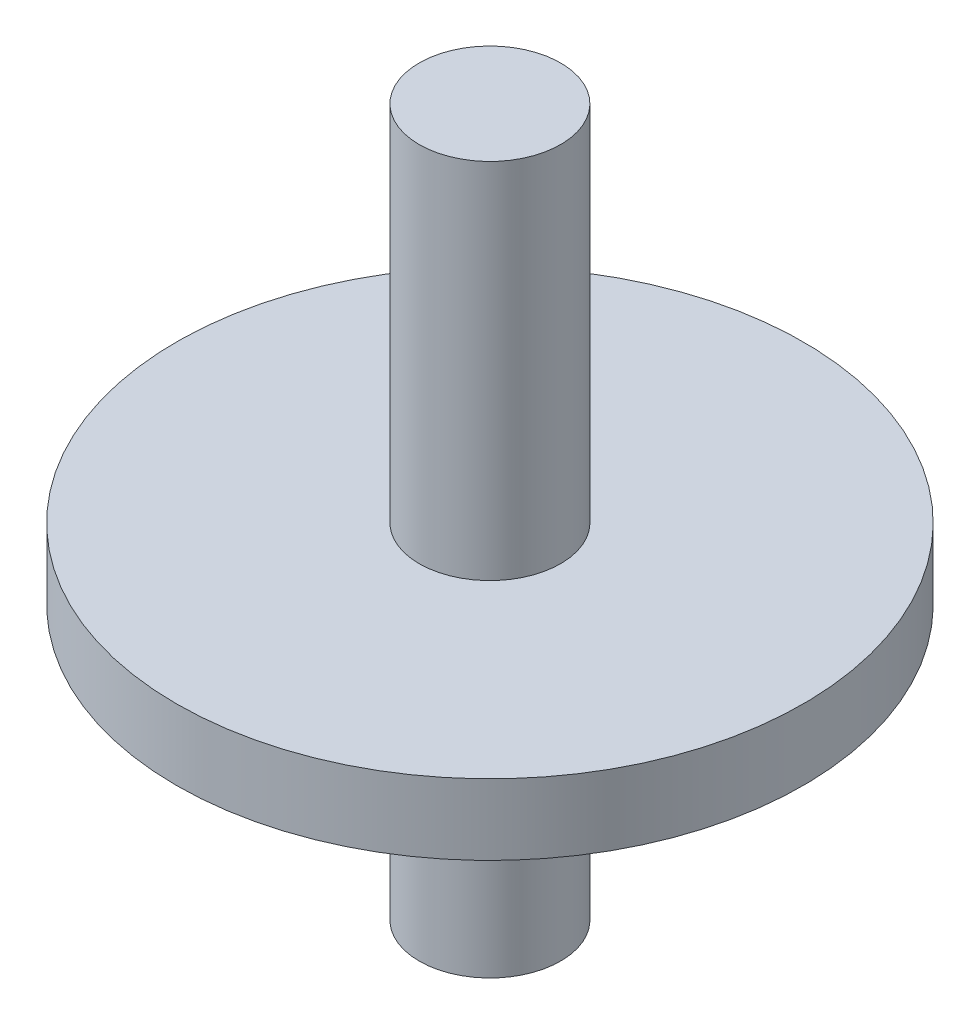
SolidWorks part; units mm, degrees
ref_plane "X Y" through (0, 0, 0) normal (0, 0, 1) x (1, 0, 0)
ref_plane "X Z" through (0, 0, 0) normal (0, 1, 0) x (1, 0, 0)
ref_plane "Y Z" through (0, 0, 0) normal (1, 0, 0) x (0, 0, -1)
sketch "Sketch1" plane through (0, 0, 0) normal (0, 0, 1) x (1, 0, 0)
  line L0 (0, 92.6609) -> (0, -79.6884) construction
  line L1 (12.7, 0) -> (12.7, 49.1103)
  line L2 (12.7, 49.1103) -> (56.2915, 49.1103)
  line L3 (56.2915, 49.1103) -> (56.2915, 61.8103)
  line L4 (56.2915, 61.8103) -> (12.7, 61.8103)
  line L5 (12.7, 61.8103) -> (12.7, 127)
  line L6 (12.7, 127) -> (0, 127)
  line L7 (12.7, 0) -> (0, 0)
  line L8 (0, 127) -> (0, 0)
  dimension "D1" = 127
  dimension "D2" = 12.7
  dimension "D3" = 56.2915
  dimension "D4" = 49.1103
  dimension "D5" = 12.7
revolve "Base-Revolve" add sketch "Sketch1" angle 360 about L0
